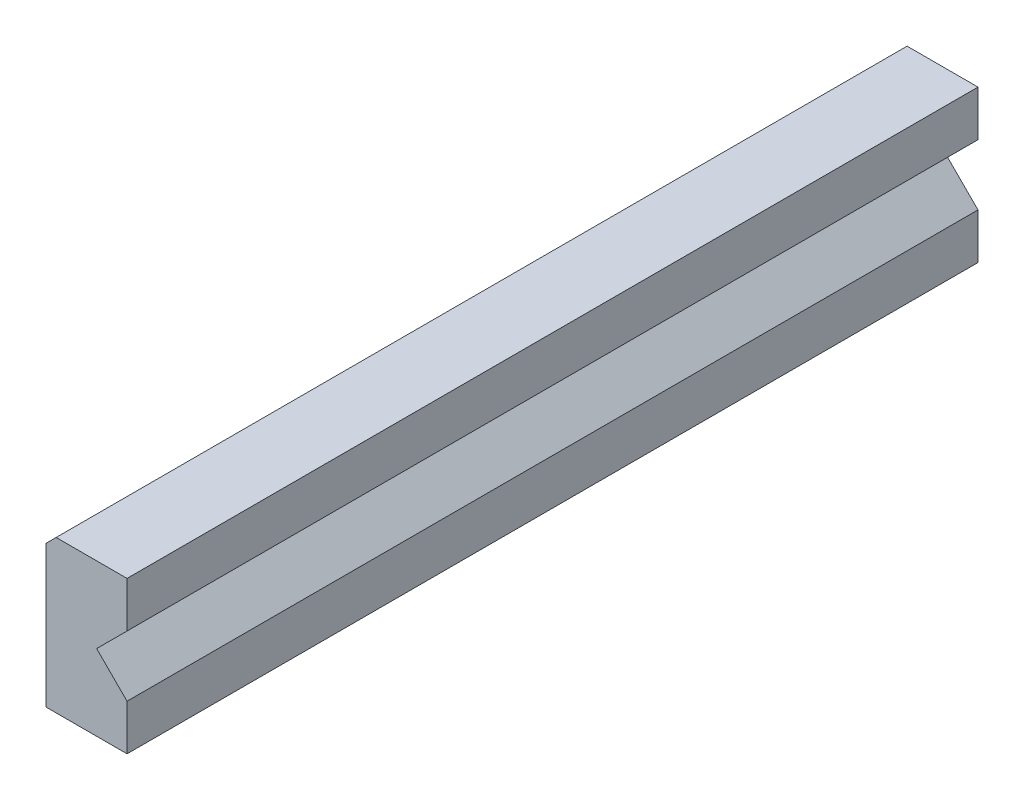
SolidWorks part; units mm, degrees
ref_plane "Face" through (0, 0, 0) normal (0, 0, 1) x (1, 0, 0)
ref_plane "Dessus" through (0, 0, 0) normal (0, 1, 0) x (1, 0, 0)
ref_plane "Droite" through (0, 0, 0) normal (1, 0, 0) x (0, 0, -1)
sketch "Esquisse1" plane through (0, 0, 0) normal (0, 0, 1) x (1, 0, 0)
  line L1 (0, 0) -> (4, 0)
  line L2 (0, 0) -> (0, 7.5)
  line L3 (0, 7.5) -> (4, 7.5)
  line L4 (4, 0) -> (4, 7.5)
  dimension "D1" = 4
  dimension "D2" = 7.5
extrude "Base-Extrusion" add sketch "Esquisse1" against normal blind 42
sketch "Esquisse5" plane through (0, 0, 0) normal (0, 0, 1) x (1, 0, 0)
  line L4 (2.5, 3.75) -> (4.2102, 5.4602)
  line L5 (2.5, 3.75) -> (4.2663, 1.9837)
  line L6 (4.2102, 5.4602) -> (4.2663, 1.9837)
extrude "Enlèv. mat.-Extru.4" cut sketch "Esquisse5" against normal through all
chamfer "Chanfrein2" distance 0.5 angle 45
